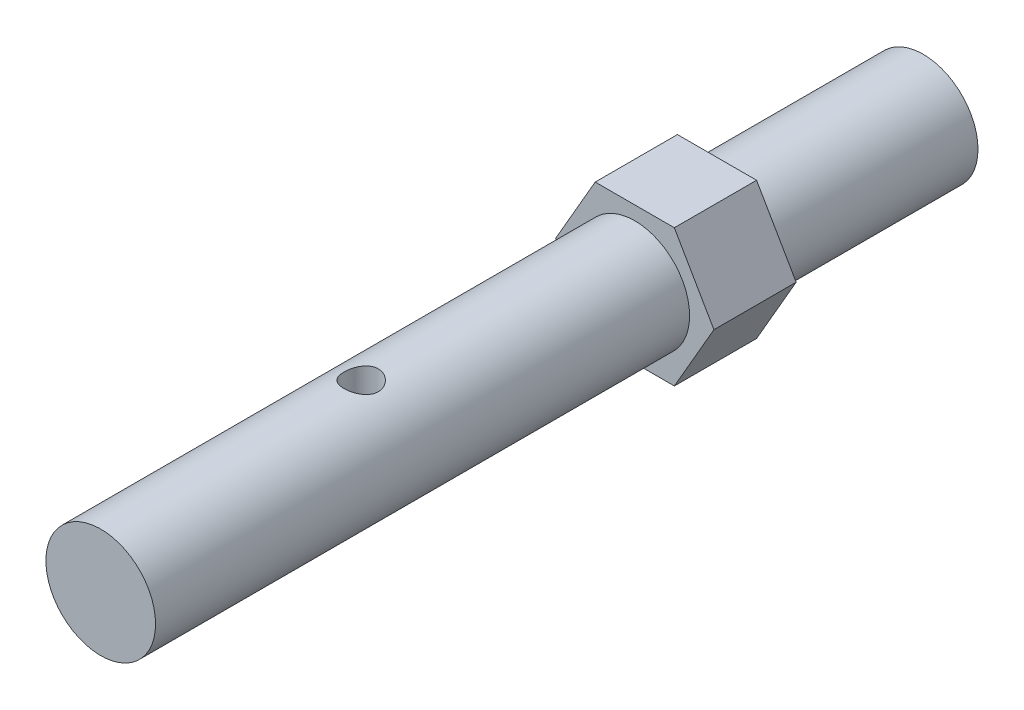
SolidWorks part; units mm, degrees
ref_plane "Front Plane" through (0, 0, 0) normal (0, 0, 1) x (1, 0, 0)
ref_plane "Top Plane" through (0, 0, 0) normal (0, 1, 0) x (1, 0, 0)
ref_plane "Right Plane" through (0, 0, 0) normal (1, 0, 0) x (0, 0, -1)
sketch "Sketch1" plane through (0, 0, 0) normal (0, 0, 1) x (1, 0, 0)
  circle A0 centre (0, 0) radius 3.175
  dimension "D1" = 6.35
extrude "Boss-Extrude1" add sketch "Sketch1" along normal mid plane 47.625
ref_plane "Plane1" through (0, 0, -7.112) normal (0, 0, 1) x (1, 0, 0)
sketch "Sketch3" plane through (0, 0, 0) normal (0, 1, 0) x (1, 0, 0)
  line L0 (0, 23.8125) -> (0, -23.8125) construction
  line L1 (3.175, 23.8125) -> (-3.175, 23.8125) construction
  line L2 (-3.175, -23.8125) -> (3.175, -23.8125) construction
  circle A0 centre (0, -8.7312) radius 0.9922
  ellipse E0 centre (-8.6003, -8.7312) end of major axis (-8.6003, -9.6837) minor radius 0.4094 (-8.2588, -9.2567) -> (-8.3566, -9.4967) ccw construction
  ellipse E1 centre (-8.6003, -8.7312) end of major axis (-8.6003, -9.6837) minor radius 0.4094 (-8.2588, -9.2567) -> (-8.3566, -9.4967) ccw construction
  point P19 (0, -8.7312)
  dimension "D1" = 1.9844
extrude "Cut-Extrude1" cut sketch "Sketch3" against normal through all both and the other way through all contours A0
sketch "Sketch2" plane through (0, 0, -7.112) normal (0, 0, 1) x (1, 0, 0)
  line L1 (4.5827, 0) -> (2.2914, 3.9688)
  line L2 (2.2914, 3.9688) -> (-2.2914, 3.9688)
  line L3 (-2.2914, 3.9688) -> (-4.5827, 0)
  line L4 (-4.5827, 0) -> (-2.2914, -3.9687)
  line L5 (-2.2914, -3.9687) -> (2.2914, -3.9687)
  line L6 (2.2914, -3.9687) -> (4.5827, 0)
  circle A0 centre (0, 0) radius 3.9687 construction
  dimension "D1" = 7.9375
extrude "Boss-Extrude2" add sketch "Sketch2" against normal blind 4.7625
